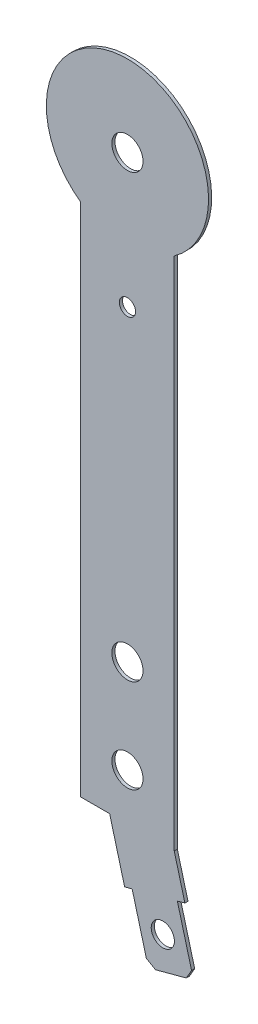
SolidWorks part; units mm, degrees
ref_plane "Front Plane" through (0, 0, 0) normal (0, 0, 1) x (1, 0, 0)
ref_plane "Top Plane" through (0, 0, 0) normal (0, 1, 0) x (1, 0, 0)
ref_plane "Right Plane" through (0, 0, 0) normal (1, 0, 0) x (0, 0, -1)
sketch "Sketch1" plane through (0, 0, 0) normal (0, 0, 1) x (1, 0, 0)
  line L0 (0, 0) -> (0, 75.2348) construction
  line L2 (-4.7625, 52.451) -> (-4.7625, 0)
  line L3 (-4.7625, 0) -> (4.7625, 0)
  line L4 (4.7625, 52.451) -> (4.7625, 0)
  arc A0 (4.7625, 52.451) -> (-4.7625, 52.451) centre (0, 59.1937) ccw
  dimension "D3" = 16.51
  dimension "D1" = 9.525
  dimension "D2" = 52.451
extrude "Boss-Extrude1" add sketch "Sketch1" along normal blind 0.3175
sketch "Sketch2" plane through (0, 0, 0.3175) normal (0, 0, 1) x (1, 0, 0)
  circle A0 centre (0, 59.1937) radius 1.5875
  dimension "D1" = 3.175
extrude "Cut-Extrude1" cut sketch "Sketch2" against normal through all
sketch "Sketch3" plane through (0, 0, 0.3175) normal (0, 0, 1) x (1, 0, 0)
  line L0 (0, 0) -> (0, 20.3348) construction
  line L1 (-4.7625, 0) -> (4.7625, 0) construction
  circle A0 centre (0, 4.7625) radius 1.5875
  circle A1 centre (0, 14.2875) radius 1.5875
  dimension "D1" = 3.175
  dimension "D2" = 9.525
  dimension "D3" = 4.7625
extrude "Cut-Extrude2" cut sketch "Sketch3" against normal through all
sketch "Sketch4" plane through (0, 0, 0.3175) normal (0, 0, 1) x (1, 0, 0)
  line L0 (0, 0) -> (0, 53.8003) construction
  line L1 (-4.7625, 0) -> (4.7625, 0) construction
  circle A0 centre (0, 45.5676) radius 0.8255
  dimension "D1" = 1.651
  dimension "D2" = 45.5676
extrude "Cut-Extrude3" cut sketch "Sketch4" against normal through all
sketch "Sketch5" plane through (0, 0, 0.3175) normal (0, 0, 1) x (1, 0, 0)
  line L0 (4.7625, 0) -> (5.8472, -4.0482)
  line L1 (-1.8115, 0) -> (-0.2864, -5.6917)
  line L2 (-0.2864, -5.6917) -> (0.4803, -5.4863)
  line L3 (-4.7625, 0) -> (4.7625, 0) construction
  line L4 (-1.8115, 0) -> (4.7625, 0)
  line L5 (-1.3711, -1.6435) -> (-0.2864, -5.6917) construction
  line L6 (4.7625, 0) -> (4.7625, 52.451) construction
  line L7 (0.4803, -5.4863) -> (2.5282, -13.1292) construction
  line L8 (2.1238, -11.6199) -> (0.4803, -5.4863)
  line L9 (2.1238, -11.6199) -> (6.724, -10.3873)
  line L11 (6.724, -10.3873) -> (5.0805, -4.2536)
  line L12 (2.1238, -11.6199) -> (5.0805, -4.2536) construction
  line L13 (0.4803, -5.4863) -> (6.724, -10.3873) construction
  line L14 (5.0805, -4.2536) -> (5.8472, -4.0482)
  point P11 (3.6021, -7.9368)
  dimension "D2" = 4.191
  dimension "D3" = 15
  dimension "D4" = 4.7625
  dimension "D5" = 6.35
  dimension "D1" = 6.35
extrude "Boss-Extrude2" add sketch "Sketch5" against normal up to surface (0.3175 mm away)
chamfer "Chamfer1" distance 0.762 angle 45 2 edges at (2.1238, -11.6199, 0.1588) (6.724, -10.3873, 0.1588)
sketch "Sketch6" plane through (0, 0, 0.3175) normal (0, 0, 1) x (1, 0, 0)
  line L0 (4.4239, -11.0036) -> (3.074, -5.9656) construction
  line L1 (2.8598, -11.4227) -> (5.988, -10.5845) construction
  circle A0 centre (3.6021, -7.9368) radius 1.1811
  dimension "D1" = 2.3622
  dimension "D2" = 3.175
extrude "Cut-Extrude4" cut sketch "Sketch6" against normal through all
